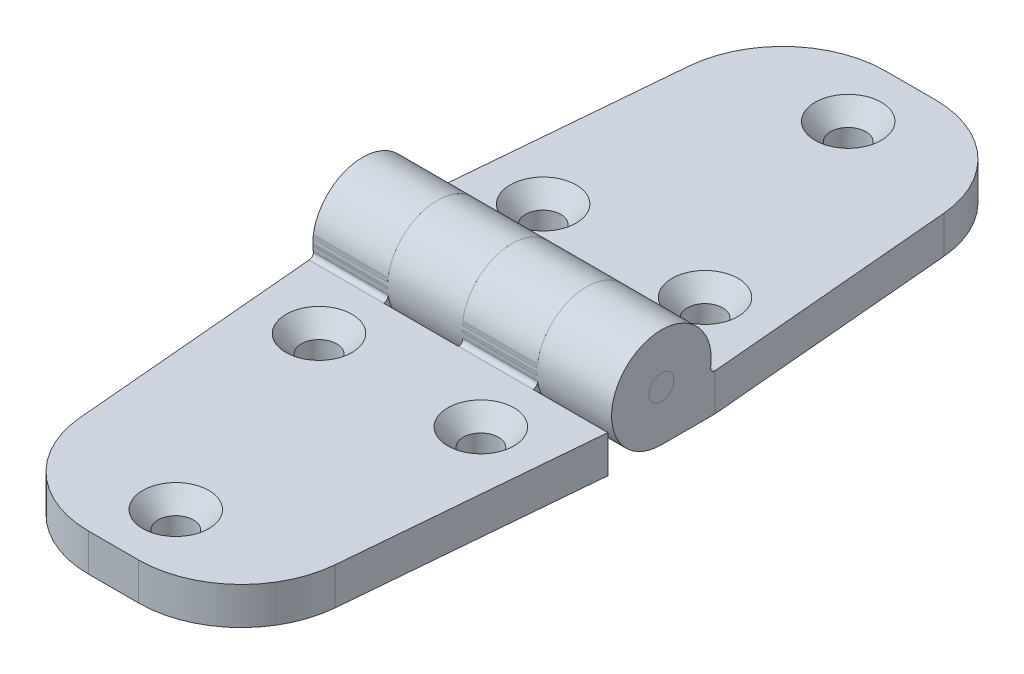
SolidWorks part; units mm, degrees
ref_plane "Front" through (0, 0, 0) normal (0, 0, 1) x (1, 0, 0)
ref_plane "Top" through (0, 0, 0) normal (0, 1, 0) x (1, 0, 0)
ref_plane "Right" through (0, 0, 0) normal (1, 0, 0) x (0, 0, -1)
sketch "Sketch1" plane through (0, 0, 0) normal (1, 0, 0) x (0, 0, -1)
  line L0 (0, 0) -> (-50.8, 0)
  line L1 (-50.8, 0) -> (-50.8, 4.7625)
  line L2 (-50.8, 4.7625) -> (0, 4.7625)
  line L3 (0, 4.7625) -> (50.8, 4.7625)
  line L4 (50.8, 4.7625) -> (50.8, 0)
  line L5 (50.8, 0) -> (0, 0)
  circle A0 centre (0, 6.35) radius 6.35
  circle A1 centre (0, 6.35) radius 1.5875
  dimension "Pin Dia" = 3.175
  dimension "Kn Dia" = 12.7
  dimension "Th" = 4.7625
  dimension "A" = 50.8
sketch "Sketch2" plane through (0, 0, 0) normal (1, 0, 0) x (0, 0, -1)
  line L0 (0, 0) -> (-50.8, 0)
  line L1 (-50.8, 0) -> (-50.8, 4.7625)
  line L2 (-50.8, 4.7625) -> (-6.8241, 4.7625)
  line L3 (-50.8, 4.7625) -> (0, 4.7625) construction
  arc A0 (0, 0) -> (-6.2782, 5.3975) centre (0, 6.35) ccw
  circle A1 centre (0, 6.35) radius 6.35 construction
  circle A2 centre (0, 6.35) radius 1.5875
  circle A3 centre (0, 6.35) radius 1.5875 construction
  arc A4 (-6.8241, 4.7625) -> (-6.2782, 5.3975) centre (-6.8241, 5.3147) ccw
  dimension "D1" = 0.635
extrude "Extrude1" add sketch "Sketch2" along normal mid plane 38.1
sketch "Sketch24" plane through (0, 0, 0) normal (0, 1, 0) x (1, 0, 0)
  line L0 (19.05, 6.35) -> (-19.05, 6.35) construction
  line L1 (-9.525, 6.35) -> (0, 6.35)
  line L2 (-9.525, 6.35) -> (-9.525, -6.8241)
  line L3 (-9.525, -6.8241) -> (0, -6.8241)
  line L4 (0, 6.35) -> (0, -6.8241)
  line L5 (9.525, 6.35) -> (19.05, 6.35)
  line L6 (9.525, 6.35) -> (9.525, -6.8241)
  line L7 (9.525, -6.8241) -> (19.05, -6.8241)
  line L8 (19.05, 6.35) -> (19.05, -6.8241)
  line L9 (19.05, -0.237) -> (9.525, -0.237) construction
  line L10 (9.525, -0.237) -> (0, -0.237) construction
  line L11 (0, -0.237) -> (-9.525, -0.237) construction
  line L12 (-9.525, -0.237) -> (-19.05, -0.237) construction
  line L13 (-19.05, 6.35) -> (-19.05, -6.35) construction
  line L16 (19.05, -6.8241) -> (-19.05, -6.8241) construction
extrude "Cut-Extrude5" cut sketch "Sketch24" along normal through all
sketch "Sketch4" plane through (0, 0, 0) normal (1, 0, 0) x (0, 0, -1)
  line L0 (0, 0) -> (50.8, 0)
  line L1 (50.8, 0) -> (50.8, 4.7625)
  line L2 (50.8, 4.7625) -> (6.8241, 4.7625)
  line L3 (0, 4.7625) -> (50.8, 4.7625) construction
  arc A0 (0, 0) -> (6.2782, 5.3975) centre (0, 6.35) cw
  circle A1 centre (0, 6.35) radius 6.35 construction
  circle A2 centre (0, 6.35) radius 1.5875
  circle A3 centre (0, 6.35) radius 1.5875 construction
  arc A4 (6.2782, 5.3975) -> (6.8241, 4.7625) centre (6.8241, 5.3147) ccw
  dimension "D1" = 0.635
extrude "Extrude2" add sketch "Sketch4" along normal up to surface and the other way up to surface separate body
sketch "Sketch25" plane through (0, 0, 0) normal (0, 1, 0) x (1, 0, 0)
  line L0 (9.525, 6.35) -> (9.525, -6.8241) construction
  line L2 (-19.05, 6.8241) -> (-9.525, 6.8241)
  line L3 (-19.05, 6.8241) -> (-19.05, -6.2782)
  line L4 (-19.05, -6.2782) -> (-9.525, -6.2782)
  line L5 (-9.525, 6.8241) -> (-9.525, -6.2782)
  line L6 (0, 6.8241) -> (9.525, 6.8241)
  line L7 (0, 6.8241) -> (0, -6.2782)
  line L8 (0, -6.2782) -> (9.525, -6.2782)
  line L9 (19.05, 6.8241) -> (-19.05, 6.8241) construction
  line L10 (-9.525, -6.2782) -> (-19.05, -6.2782) construction
  line L12 (9.525, 6.8241) -> (9.525, -6.2782)
extrude "Cut-Extrude6" cut sketch "Sketch25" along normal through all
ref_plane "Plane1" through (0, 6.35, 0) normal (0, 1, 0) x (-1, 0, 0)
sketch "Sketch7" plane through (0, 6.35, 0) normal (0, 1, 0) x (-1, 0, 0)
  line L0 (-19.05, 0) -> (19.05, 0)
  line L1 (-19.05, -1.5875) -> (-19.05, 0)
  line L2 (-19.05, -1.5875) -> (19.05, -1.5875)
  line L3 (19.05, -1.5875) -> (19.05, 0)
  point P5 (0, -1.5875)
revolve "Revolve1" add sketch "Sketch7" angle 360 about L0
sketch "Sketch8" plane through (0, 4.7625, 0) normal (0, 1, 0) x (-1, 0, 0)
  line L0 (-19.05, -6.8241) -> (-16.2509, -38.8182)
  line L1 (19.05, -6.8241) -> (16.2509, -38.8182)
  line L2 (-19.05, -6.8241) -> (-22.1191, -6.8241)
  line L3 (-22.1191, -6.8241) -> (-22.1191, -53.4641)
  line L4 (-22.1191, -53.4641) -> (22.1191, -53.4641)
  line L5 (22.1191, -53.4641) -> (22.1191, -6.8241)
  line L6 (22.1191, -6.8241) -> (19.05, -6.8241)
  line L7 (19.05, -6.8241) -> (19.05, -50.8) construction
  line L10 (-19.05, -50.8) -> (-19.05, -6.8241) construction
  line L11 (3.175, -50.8) -> (-3.175, -50.8)
  line L12 (-19.05, -50.8) -> (19.05, -50.8) construction
  line L13 (3.175, 50.8) -> (-3.175, 50.8)
  line L14 (-19.05, 50.8) -> (19.05, 50.8) construction
  line L15 (9.525, -6.8241) -> (19.05, -6.8241) construction
  line L16 (19.05, 0) -> (-19.05, 0) construction
  line L17 (22.1191, 6.8241) -> (19.05, 6.8241)
  line L18 (22.1191, 53.4641) -> (22.1191, 6.8241)
  line L19 (-22.1191, 53.4641) -> (22.1191, 53.4641)
  line L20 (-22.1191, 6.8241) -> (-22.1191, 53.4641)
  line L21 (-19.05, 6.8241) -> (-22.1191, 6.8241)
  line L22 (19.05, 6.8241) -> (16.2509, 38.8182)
  line L23 (-19.05, 6.8241) -> (-16.2509, 38.8182)
  line L24 (-19.05, -6.35) -> (-19.05, 6.8241) construction
  arc A1 (3.175, -50.8) -> (16.2509, -38.8182) centre (3.175, -37.6742) ccw
  arc A2 (-3.175, -50.8) -> (-16.2509, -38.8182) centre (-3.175, -37.6742) cw
  arc A3 (16.2509, 38.8182) -> (3.175, 50.8) centre (3.175, 37.6742) ccw
  arc A4 (-16.2509, 38.8182) -> (-3.175, 50.8) centre (-3.175, 37.6742) cw
  point P37 (0, -50.8)
  dimension "D1" = 85
  dimension "D2" = 6.35
extrude "Cut-Extrude4" cut sketch "Sketch8" against normal blind 1056.132
sketch "Sketch9" plane through (0, 4.7625, 0) normal (0, 1, 0) x (-1, 0, 0)
  line L0 (19.05, -6.35) -> (19.05, 6.35) construction
  line L1 (19.05, 0) -> (-19.05, 0) construction
  line L4 (-19.05, -6.35) -> (-19.05, 6.8241) construction
  line L5 (0, -50.8) -> (0, 0) construction
  line L6 (3.175, -50.8) -> (-3.175, -50.8) construction
  line L7 (0, -42.8625) -> (0, -50.8) construction
  point P20 (0, -42.8625)
  point P21 (10.3187, -14.2875)
  point P28 (-10.3188, -14.2875)
  point P33 (-10.3188, 14.2875)
  point P34 (10.3187, 14.2875)
  point P35 (0, 42.8625)
  dimension "D1" = 20.6375
  dimension "D2" = 7.9375
  dimension "D3" = 28.575
hole_wizard "CSK for #8 Flat Head Machine Screw1" positions "Sketch14" profile "Sketch13" countersink size "#8" standard "Ansi Inch"
sketch "Sketch14" plane through (-3.1926, 4.7625, 34.0762) normal (0, 1, 0) x (-1, 0, 0)
  point P31 (-3.1926, -76.9387)
  point P34 (7.1262, -48.3637)
  point P37 (-13.5113, -48.3637)
  point P40 (7.1262, -19.7887)
  point P43 (-13.5113, -19.7887)
  point P46 (-3.1926, 8.7863)
sketch "Sketch13" plane through (0, 4.7625, -42.8625) normal (1, 0, 0) x (0, 0, 1)
  line L0 (0, 0) -> (0, 4.7625)
  line L1 (0, 4.7625) -> (2.2479, 4.7625)
  line L2 (2.2479, 4.7625) -> (2.2479, 2.2645)
  line L3 (2.2479, 2.2645) -> (4.2164, 0)
  line L5 (4.2164, 0) -> (0, 0)
  line L6 (-2.2479, 2.2645) -> (-4.2164, 0) construction
  line L11 (0, -6.35) -> (0, 107.95) construction
  dimension "Thru Hole Dia." = 4.4958
  dimension "Thru Hole Depth" = 4.7625
  dimension "Near C'Sink Dia." = 8.4328
  dimension "Near C'Sink Angle" = 82
